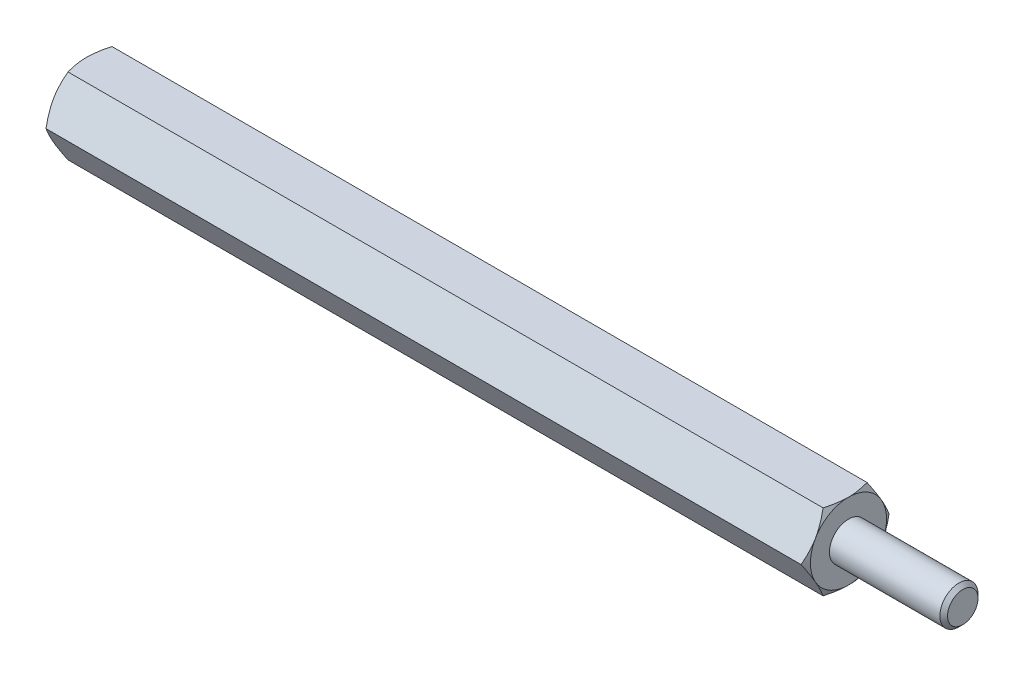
SolidWorks part; units mm, degrees
ref_plane "Front Plane" through (0, 0, 0) normal (0, 0, 1) x (1, 0, 0)
ref_plane "Top Plane" through (0, 0, 0) normal (0, 1, 0) x (1, 0, 0)
ref_plane "Right Plane" through (0, 0, 0) normal (1, 0, 0) x (0, 0, -1)
sketch "Sketch1" plane through (0, 0, 0) normal (1, 0, 0) x (0, 0, -1)
  line L1 (1.1547, 2) -> (-1.1547, 2)
  line L2 (-1.1547, 2) -> (-2.3094, 0)
  line L3 (-2.3094, 0) -> (-1.1547, -2)
  line L4 (-1.1547, -2) -> (1.1547, -2)
  line L5 (1.1547, -2) -> (2.3094, 0)
  line L6 (2.3094, 0) -> (1.1547, 2)
  circle A0 centre (0, 0) radius 2 construction
  dimension "D1" = 4
extrude "Extrude2" add sketch "Sketch1" along normal mid plane 40
sketch "Sketch2" plane through (0, 0, 0) normal (0, 0, 1) x (1, 0, 0)
  line L0 (-20, 2) -> (-18.5, 4.5981)
  line L1 (-20, 5) -> (-20, 2)
  line L3 (0, 0) -> (50000, 0) construction
  arc A0 (-18.5, 4.5981) -> (-20, 5) centre (-19.1962, 5) ccw
  dimension "D1" = 30
  dimension "D2" = 3
revolve "Cut-Revolve1" cut sketch "Sketch2" angle 360 about L3
mirror "Mirror1" about plane through (0, 0, 0) normal (1, 0, 0) of "Cut-Revolve1"
sketch "Sketch3" plane through (-20, 0, 0) normal (-1, 0, 0) x (0, 0, 1)
  circle A0 centre (0, 0) radius 0.8
  dimension "D1" = 1.6
extrude "Extrude3" cut sketch "Sketch3" against normal blind 6
sketch "Sketch4" plane through (0, 0, 0) normal (0, 0, 1) x (1, 0, 0)
  line L0 (-14, 0) -> (-14, 0.8)
  line L1 (19.8214, 0) -> (-19.8214, 0) construction
  line L2 (-14, 0.8) -> (-13.5381, 0)
  line L3 (-13.5381, 0) -> (-14, 0)
  line L4 (-20, 1) -> (-20, -1) construction
  point P4 (-20, 0)
  dimension "D1" = 30
  dimension "D2" = 0.8
  dimension "D3" = 6
revolve "Cut-Revolve2" cut sketch "Sketch4" angle 360 about L3
sketch "Sketch5" plane through (20, 0, 0) normal (1, 0, 0) x (0, 0, -1)
  circle A0 centre (0, 0) radius 1
  dimension "D1" = 2
extrude "Extrude4" add sketch "Sketch5" along normal blind 6
chamfer "Chamfer1" distance 0.2 angle 45 1 edges at (26, 0, -1)
equation "\"D2@Sketch4\" = \"D1@Sketch3\"/2"
